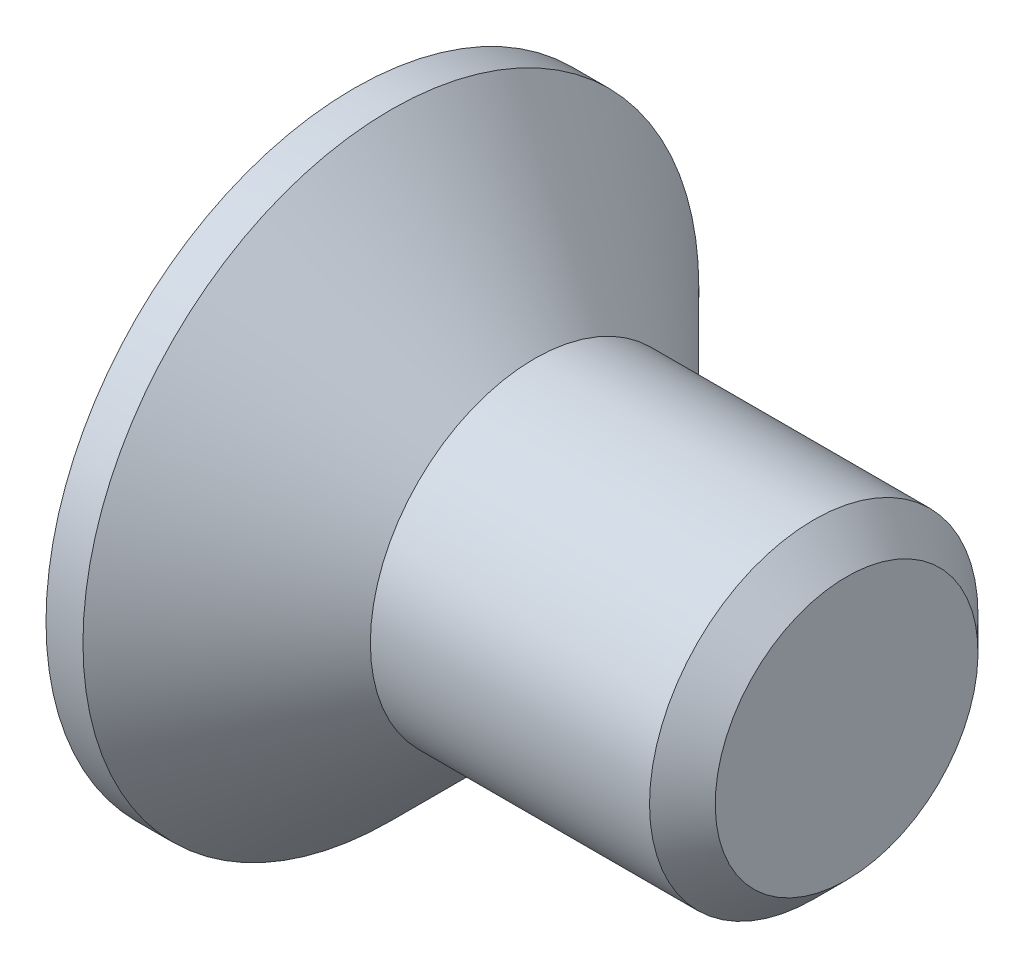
SolidWorks part; units mm, degrees
ref_plane "Front Plane" through (0, 0, 0) normal (0, 0, 1) x (1, 0, 0)
ref_plane "Top Plane" through (0, 0, 0) normal (0, 1, 0) x (1, 0, 0)
ref_plane "Right Plane" through (0, 0, 0) normal (1, 0, 0) x (0, 0, -1)
sketch "Sketch1" plane through (0, 0, 0) normal (0, 0, 1) x (1, 0, 0)
  line L1 (-2.2, 3.75) -> (-2.2, 0)
  line L2 (-2.2, 0) -> (3.8, 0)
  line L3 (3.8, 0) -> (3.8, 2)
  line L4 (3.8, 2) -> (0, 2)
  line L5 (-2.2, 3.75) -> (-1.75, 3.75)
  line L6 (-1.75, 3.75) -> (0, 2)
  dimension "D1" = 2
  dimension "D2" = 45
  dimension "D3" = 2.2
  dimension "D4" = 6
  dimension "D5" = 3.75
revolve "Revolve1" add sketch "Sketch1" angle 360 about L2
chamfer "Chamfer1" distance 0.4 angle 45 1 edges at (3.8, -2, 0)
sketch "Sketch2" plane through (-2.2, 0, 0) normal (-1, 0, 0) x (0, 0, 1)
  line L0 (-0.55, 2.2) -> (0.55, 2.2)
  line L1 (0.55, 2.2) -> (0.55, 0.55)
  line L2 (0.55, 0.55) -> (2.2, 0.55)
  line L3 (2.2, 0.55) -> (2.2, -0.55)
  line L4 (2.2, -0.55) -> (0.55, -0.55)
  line L5 (0.55, -0.55) -> (0.55, -2.2)
  line L6 (0.55, -2.2) -> (-0.55, -2.2)
  line L7 (-0.55, -2.2) -> (-0.55, -0.55)
  line L8 (-0.55, -0.55) -> (-2.2, -0.55)
  line L9 (-2.2, -0.55) -> (-2.2, 0.55)
  line L10 (-2.2, 0.55) -> (-0.55, 0.55)
  line L11 (-0.55, 0.55) -> (-0.55, 2.2)
  point P2 (0, 2.2)
  point P14 (0, -2.2)
  point P15 (2.2, 0)
  point P16 (-2.2, 0)
  dimension "D1" = 4.4
  dimension "D2" = 1.1
extrude "Cut-Extrude1" cut sketch "Sketch2" against normal blind 1.9
